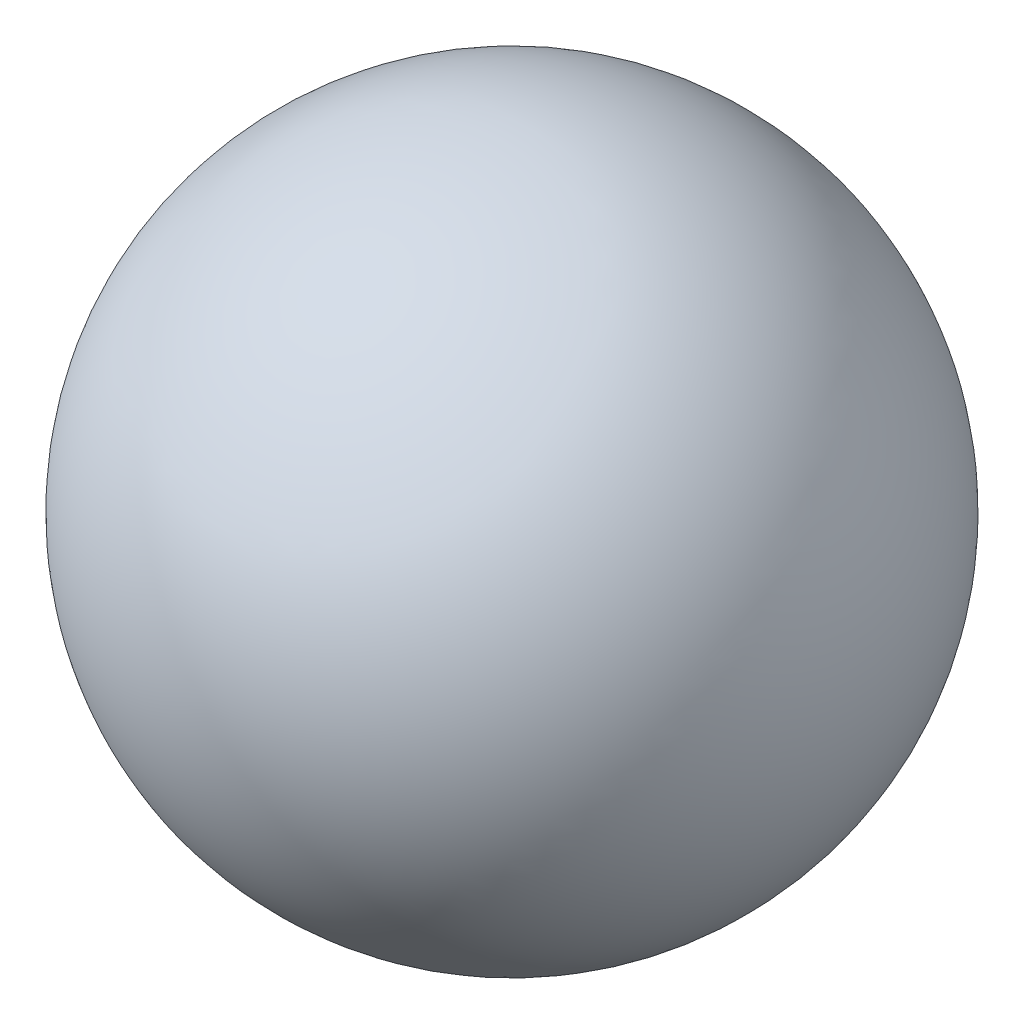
SolidWorks part; units mm, degrees
ref_plane "Front Plane" through (0, 0, 0) normal (0, 0, 1) x (1, 0, 0)
ref_plane "Top Plane" through (0, 0, 0) normal (0, 1, 0) x (1, 0, 0)
ref_plane "Right Plane" through (0, 0, 0) normal (1, 0, 0) x (0, 0, -1)
sketch "Sketch1" plane through (0, 0, 0) normal (0, 1, 0) x (1, 0, 0)
  line L0 (0, 1.5) -> (0, -1.5)
  arc A0 (0, 1.5) -> (0, -1.5) centre (0, 0) ccw
  dimension "D1" = 3
  dimension "D2" = 1.5
revolve "Revolve8" add sketch "Sketch1" angle 360 about L0
